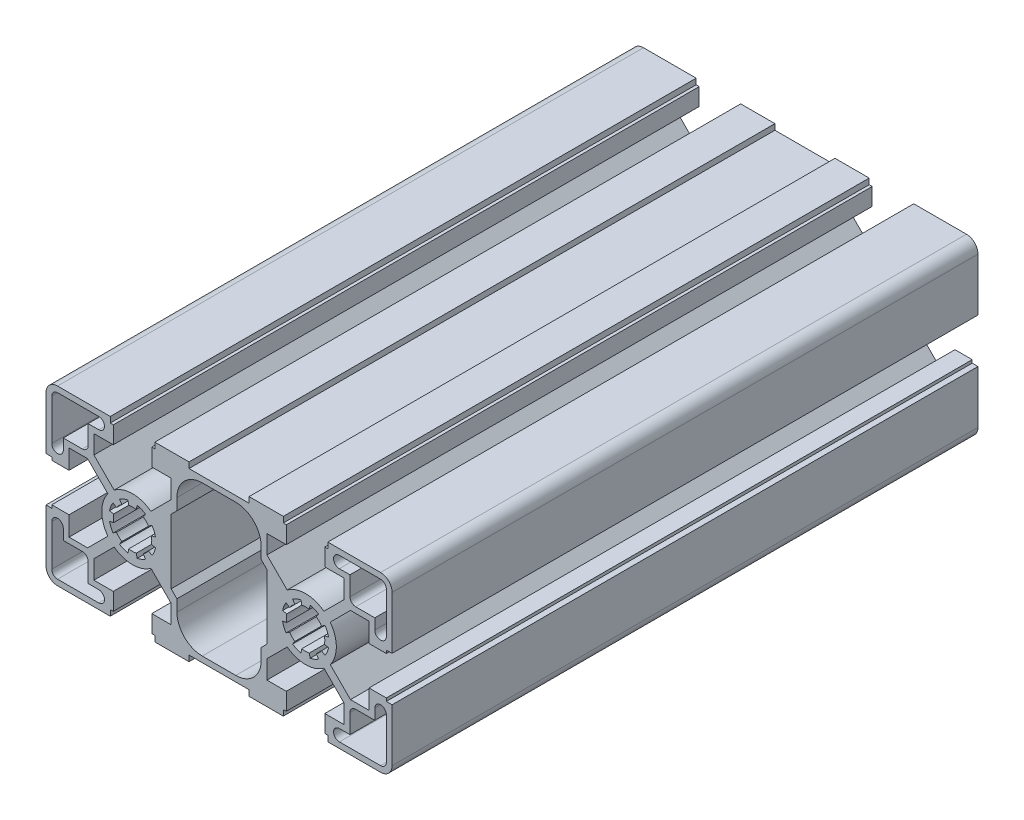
SolidWorks part; units mm, degrees
ref_plane "Front Plane" through (0, 0, 0) normal (0, 0, 1) x (1, 0, 0)
ref_plane "Top Plane" through (0, 0, 0) normal (0, 1, 0) x (1, 0, 0)
ref_plane "Right Plane" through (0, 0, 0) normal (1, 0, 0) x (0, 0, -1)
sketch "Sketch1" plane through (0, 0, 0) normal (0, 0, 1) x (1, 0, 0)
  line L0 (-27.5082, 0) -> (-17.5006, 0) construction
  line L1 (17.5006, 0) -> (27.5082, 0) construction
  line L2 (-42.0116, 22.5044) -> (-28.2956, 22.5044)
  line L3 (-28.2956, 22.5044) -> (-28.2956, 21.0058)
  line L4 (-28.2956, 21.0058) -> (-27.5082, 21.0058)
  line L5 (22.5044, -5.0038) -> (22.5044, 5.0038) construction
  line L6 (-27.5082, 21.0058) -> (-27.5082, 16.51)
  line L7 (-27.5082, 16.51) -> (-32.5501, 16.51)
  line L8 (-32.5501, 16.51) -> (-32.5501, 11.6801)
  line L9 (-32.5501, 11.6801) -> (-27.2854, 6.4154)
  line L11 (-34.1845, 10.0457) -> (-28.9198, 4.781)
  line L12 (-39.0144, 10.0457) -> (-34.1845, 10.0457)
  line L13 (-39.0144, 5.0038) -> (-39.0144, 10.0457)
  line L14 (-43.5102, 5.0038) -> (-39.0144, 5.0038)
  line L15 (-43.5102, 5.7912) -> (-43.5102, 5.0038)
  line L16 (-45.0088, 5.7912) -> (-43.5102, 5.7912)
  line L17 (-45.0088, 19.5072) -> (-45.0088, 5.7912)
  line L18 (-40.513, 11.5443) -> (-35.5473, 11.5443)
  line L19 (-40.513, 11.5443) -> (-40.513, 8.7884)
  line L20 (-34.0487, 18.0086) -> (-34.0487, 13.0429)
  line L21 (-43.5102, 19.5072) -> (-43.5102, 8.7884)
  line L23 (-34.0487, 18.0086) -> (-31.2928, 18.0086)
  line L24 (-42.0116, 21.0058) -> (-31.2928, 21.0058)
  line L25 (-21.3151, 5.9789) -> (-21.5282, 4.9077)
  line L26 (-23.6937, 5.9789) -> (-23.4806, 4.9077)
  line L27 (-17.4358, 3.3868) -> (-18.3439, 2.78)
  line L28 (-19.1176, 5.0686) -> (-19.7244, 4.1605)
  line L29 (-16.5255, -1.1893) -> (-17.5967, -0.9762)
  line L30 (-16.5255, 1.1893) -> (-17.5967, 0.9762)
  line L31 (-19.1176, -5.0686) -> (-19.7244, -4.1605)
  line L32 (-17.4358, -3.3868) -> (-18.3439, -2.78)
  line L33 (-23.6937, -5.9789) -> (-23.4806, -4.9077)
  line L34 (-21.3151, -5.9789) -> (-21.5282, -4.9077)
  line L35 (-27.573, -3.3868) -> (-26.6649, -2.78)
  line L36 (-25.8912, -5.0686) -> (-25.2844, -4.1605)
  line L37 (-28.4833, 1.1893) -> (-27.4121, 0.9762)
  line L38 (-28.4833, -1.1893) -> (-27.4121, -0.9762)
  line L39 (-25.8912, 5.0686) -> (-25.2844, 4.1605)
  line L40 (-27.573, 3.3868) -> (-26.6649, 2.78)
  line L41 (-7.8105, 22.5044) -> (-7.8105, 21.0058)
  line L42 (-7.8105, 21.0058) -> (7.8105, 21.0058)
  line L43 (-7.8105, 22.5044) -> (-16.7132, 22.5044)
  line L44 (-16.7132, 22.5044) -> (-16.7132, 21.0058)
  line L45 (-16.7132, 21.0058) -> (-17.5006, 21.0058)
  line L46 (-17.5006, 21.0058) -> (-17.5006, 16.51)
  line L47 (-17.5006, 16.51) -> (-12.4587, 16.51)
  line L48 (-12.4587, 16.51) -> (-12.4587, 11.6801)
  line L49 (-12.4587, 11.6801) -> (-17.7234, 6.4154)
  line L50 (-10.9601, 9.9099) -> (-12.4587, 8.4113)
  line L51 (7.8105, 21.0058) -> (7.8105, 22.5044)
  line L53 (-7.8105, -22.5044) -> (-16.7132, -22.5044)
  line L54 (7.8105, -22.5044) -> (16.7132, -22.5044)
  line L55 (7.8105, -21.0058) -> (7.8105, -22.5044)
  line L56 (-7.8105, -21.0058) -> (7.8105, -21.0058)
  line L57 (-7.8105, -22.5044) -> (-7.8105, -21.0058)
  line L58 (-40.513, -11.5443) -> (-35.5473, -11.5443)
  line L59 (4.3561, 19.5072) -> (-4.3561, 19.5072)
  line L60 (-10.9601, 12.9032) -> (-10.9601, 9.9099)
  line L61 (-12.4587, -8.4113) -> (-10.9601, -9.9099)
  line L62 (-12.4587, 8.4113) -> (-12.4587, -8.4113)
  line L63 (-10.9601, -12.9032) -> (-10.9601, -9.9099)
  line L64 (4.3561, -19.5072) -> (-4.3561, -19.5072)
  line L65 (10.9601, 12.9032) -> (10.9601, 9.9099)
  line L66 (10.9601, -12.9032) -> (10.9601, -9.9099)
  line L67 (12.4587, 8.4113) -> (12.4587, -8.4113)
  line L68 (10.9601, -9.9099) -> (12.4587, -8.4113)
  line L69 (10.9601, 9.9099) -> (12.4587, 8.4113)
  line L70 (-12.4587, -11.6801) -> (-17.7234, -6.4154)
  line L71 (-12.4587, -16.51) -> (-12.4587, -11.6801)
  line L72 (-17.5006, -16.51) -> (-12.4587, -16.51)
  line L73 (-17.5006, -21.0058) -> (-17.5006, -16.51)
  line L74 (-16.7132, -21.0058) -> (-17.5006, -21.0058)
  line L75 (-16.7132, -22.5044) -> (-16.7132, -21.0058)
  line L76 (-34.0487, -18.0086) -> (-31.2928, -18.0086)
  line L77 (-42.0116, -21.0058) -> (-31.2928, -21.0058)
  line L78 (-42.0116, -22.5044) -> (-28.2956, -22.5044)
  line L79 (-28.2956, -22.5044) -> (-28.2956, -21.0058)
  line L80 (-28.2956, -21.0058) -> (-27.5082, -21.0058)
  line L81 (-27.5082, -21.0058) -> (-27.5082, -16.51)
  line L82 (-27.5082, -16.51) -> (-32.5501, -16.51)
  line L83 (-32.5501, -16.51) -> (-32.5501, -11.6801)
  line L84 (-32.5501, -11.6801) -> (-27.2854, -6.4154)
  line L85 (-34.1845, -10.0457) -> (-28.9198, -4.781)
  line L86 (-43.5102, -19.5072) -> (-43.5102, -8.7884)
  line L87 (-34.0487, -18.0086) -> (-34.0487, -13.0429)
  line L88 (-40.513, -11.5443) -> (-40.513, -8.7884)
  line L89 (-45.0088, -19.5072) -> (-45.0088, -5.7912)
  line L90 (-45.0088, -5.7912) -> (-43.5102, -5.7912)
  line L91 (-43.5102, -5.7912) -> (-43.5102, -5.0038)
  line L92 (-43.5102, -5.0038) -> (-39.0144, -5.0038)
  line L93 (-39.0144, -5.0038) -> (-39.0144, -10.0457)
  line L94 (-39.0144, -10.0457) -> (-34.1845, -10.0457)
  line L96 (42.0116, 21.0058) -> (31.2928, 21.0058)
  line L97 (42.0116, 22.5044) -> (28.2956, 22.5044)
  line L98 (34.0487, 18.0086) -> (31.2928, 18.0086)
  line L99 (27.5082, 21.0058) -> (27.5082, 16.51)
  line L100 (28.2956, 21.0058) -> (27.5082, 21.0058)
  line L101 (28.2956, 22.5044) -> (28.2956, 21.0058)
  line L102 (17.5006, 21.0058) -> (17.5006, 16.51)
  line L103 (16.7132, 21.0058) -> (17.5006, 21.0058)
  line L104 (16.7132, 22.5044) -> (16.7132, 21.0058)
  line L105 (7.8105, 22.5044) -> (16.7132, 22.5044)
  line L106 (39.0144, -10.0457) -> (34.1845, -10.0457)
  line L107 (39.0144, -5.0038) -> (39.0144, -10.0457)
  line L108 (43.5102, -5.0038) -> (39.0144, -5.0038)
  line L109 (43.5102, -5.7912) -> (43.5102, -5.0038)
  line L110 (45.0088, -5.7912) -> (43.5102, -5.7912)
  line L111 (45.0088, -19.5072) -> (45.0088, -5.7912)
  line L112 (40.513, -11.5443) -> (35.5473, -11.5443)
  line L113 (40.513, -11.5443) -> (40.513, -8.7884)
  line L114 (34.0487, -18.0086) -> (34.0487, -13.0429)
  line L115 (43.5102, -19.5072) -> (43.5102, -8.7884)
  line L116 (34.1845, -10.0457) -> (28.9198, -4.781)
  line L117 (32.5501, -11.6801) -> (27.2854, -6.4154)
  line L118 (32.5501, -16.51) -> (32.5501, -11.6801)
  line L119 (27.5082, -16.51) -> (32.5501, -16.51)
  line L120 (27.5082, -21.0058) -> (27.5082, -16.51)
  line L121 (28.2956, -21.0058) -> (27.5082, -21.0058)
  line L122 (28.2956, -22.5044) -> (28.2956, -21.0058)
  line L123 (42.0116, -22.5044) -> (28.2956, -22.5044)
  line L124 (42.0116, -21.0058) -> (31.2928, -21.0058)
  line L125 (34.0487, -18.0086) -> (31.2928, -18.0086)
  line L126 (16.7132, -22.5044) -> (16.7132, -21.0058)
  line L127 (16.7132, -21.0058) -> (17.5006, -21.0058)
  line L128 (17.5006, -21.0058) -> (17.5006, -16.51)
  line L129 (17.5006, -16.51) -> (12.4587, -16.51)
  line L130 (12.4587, -16.51) -> (12.4587, -11.6801)
  line L131 (12.4587, -11.6801) -> (17.7234, -6.4154)
  line L132 (12.4587, 11.6801) -> (17.7234, 6.4154)
  line L133 (12.4587, 16.51) -> (12.4587, 11.6801)
  line L134 (27.573, 3.3868) -> (26.6649, 2.78)
  line L135 (25.8912, 5.0686) -> (25.2844, 4.1605)
  line L136 (28.4833, -1.1893) -> (27.4121, -0.9762)
  line L137 (28.4833, 1.1893) -> (27.4121, 0.9762)
  line L138 (25.8912, -5.0686) -> (25.2844, -4.1605)
  line L139 (27.573, -3.3868) -> (26.6649, -2.78)
  line L140 (21.3151, -5.9789) -> (21.5282, -4.9077)
  line L141 (23.6937, -5.9789) -> (23.4806, -4.9077)
  line L142 (17.4358, -3.3868) -> (18.3439, -2.78)
  line L143 (19.1176, -5.0686) -> (19.7244, -4.1605)
  line L144 (16.5255, 1.1893) -> (17.5967, 0.9762)
  line L145 (16.5255, -1.1893) -> (17.5967, -0.9762)
  line L146 (19.1176, 5.0686) -> (19.7244, 4.1605)
  line L147 (17.4358, 3.3868) -> (18.3439, 2.78)
  line L148 (23.6937, 5.9789) -> (23.4806, 4.9077)
  line L149 (21.3151, 5.9789) -> (21.5282, 4.9077)
  line L150 (43.5102, 19.5072) -> (43.5102, 8.7884)
  line L151 (34.0487, 18.0086) -> (34.0487, 13.0429)
  line L152 (40.513, 11.5443) -> (40.513, 8.7884)
  line L153 (40.513, 11.5443) -> (35.5473, 11.5443)
  line L154 (45.0088, 19.5072) -> (45.0088, 5.7912)
  line L155 (45.0088, 5.7912) -> (43.5102, 5.7912)
  line L156 (43.5102, 5.7912) -> (43.5102, 5.0038)
  line L157 (43.5102, 5.0038) -> (39.0144, 5.0038)
  line L158 (39.0144, 5.0038) -> (39.0144, 10.0457)
  line L159 (39.0144, 10.0457) -> (34.1845, 10.0457)
  line L160 (34.1845, 10.0457) -> (28.9198, 4.781)
  line L161 (32.5501, 11.6801) -> (27.2854, 6.4154)
  line L162 (32.5501, 16.51) -> (32.5501, 11.6801)
  line L163 (12.4587, 16.51) -> (17.5006, 16.51)
  line L164 (27.5082, 16.51) -> (32.5501, 16.51)
  arc A0 (-45.0088, 19.5072) -> (-42.0116, 22.5044) centre (-42.0116, 19.5072) cw
  arc A1 (-43.5102, 8.7884) -> (-40.513, 8.7884) centre (-42.0116, 8.7884) ccw
  arc A2 (-43.5102, 19.5072) -> (-42.0116, 21.0058) centre (-42.0116, 19.5072) cw
  arc A3 (-31.2928, 21.0058) -> (-31.2928, 18.0086) centre (-31.2928, 19.5072) cw
  arc A4 (-34.0487, 13.0429) -> (-35.5473, 11.5443) centre (-35.5473, 13.0429) cw
  arc A6 (-21.5282, 4.9077) -> (-23.4806, 4.9077) centre (-22.5044, 0) ccw
  arc A7 (-27.573, 3.3868) -> (-28.4833, 1.1893) centre (-22.5044, 0) ccw
  arc A8 (-18.3439, 2.78) -> (-19.7244, 4.1605) centre (-22.5044, 0) ccw
  arc A9 (-17.5967, -0.9762) -> (-17.5967, 0.9762) centre (-22.5044, 0) ccw
  arc A10 (-19.7244, -4.1605) -> (-18.3439, -2.78) centre (-22.5044, 0) ccw
  arc A11 (-23.4806, -4.9077) -> (-21.5282, -4.9077) centre (-22.5044, 0) ccw
  arc A12 (-26.6649, -2.78) -> (-25.2844, -4.1605) centre (-22.5044, 0) ccw
  arc A13 (-27.4121, 0.9762) -> (-27.4121, -0.9762) centre (-22.5044, 0) ccw
  arc A14 (-25.2844, 4.1605) -> (-26.6649, 2.78) centre (-22.5044, 0) ccw
  arc A15 (-28.4833, -1.1893) -> (-27.573, -3.3868) centre (-22.5044, 0) ccw
  arc A16 (-25.8912, -5.0686) -> (-23.6937, -5.9789) centre (-22.5044, 0) ccw
  arc A17 (-21.3151, -5.9789) -> (-19.1176, -5.0686) centre (-22.5044, 0) ccw
  arc A18 (-17.4358, -3.3868) -> (-16.5255, -1.1893) centre (-22.5044, 0) ccw
  arc A19 (-16.5255, 1.1893) -> (-17.4358, 3.3868) centre (-22.5044, 0) ccw
  arc A20 (-19.1176, 5.0686) -> (-21.3151, 5.9789) centre (-22.5044, 0) ccw
  arc A21 (-23.6937, 5.9789) -> (-25.8912, 5.0686) centre (-22.5044, 0) ccw
  arc A22 (-34.0487, -13.0429) -> (-35.5473, -11.5443) centre (-35.5473, -13.0429) ccw
  arc A23 (-4.3561, 19.5072) -> (-10.9601, 12.9032) centre (-4.3561, 12.9032) ccw
  arc A24 (-4.3561, -19.5072) -> (-10.9601, -12.9032) centre (-4.3561, -12.9032) cw
  arc A25 (4.3561, 19.5072) -> (10.9601, 12.9032) centre (4.3561, 12.9032) cw
  arc A26 (4.3561, -19.5072) -> (10.9601, -12.9032) centre (4.3561, -12.9032) ccw
  arc A27 (-31.2928, -21.0058) -> (-31.2928, -18.0086) centre (-31.2928, -19.5072) ccw
  arc A28 (-43.5102, -19.5072) -> (-42.0116, -21.0058) centre (-42.0116, -19.5072) ccw
  arc A29 (-45.0088, -19.5072) -> (-42.0116, -22.5044) centre (-42.0116, -19.5072) ccw
  arc A30 (-43.5102, -8.7884) -> (-40.513, -8.7884) centre (-42.0116, -8.7884) cw
  arc A31 (-17.7234, 6.4154) -> (-27.2854, 6.4154) centre (-22.5044, 0) ccw
  arc A32 (-27.2854, -6.4154) -> (-17.7234, -6.4154) centre (-22.5044, 0) ccw
  arc A33 (-28.9198, 4.781) -> (-28.9198, -4.781) centre (-22.5044, 0) ccw
  arc A34 (45.0088, 19.5072) -> (42.0116, 22.5044) centre (42.0116, 19.5072) ccw
  arc A35 (43.5102, 19.5072) -> (42.0116, 21.0058) centre (42.0116, 19.5072) ccw
  arc A36 (31.2928, 21.0058) -> (31.2928, 18.0086) centre (31.2928, 19.5072) ccw
  arc A37 (28.9198, 4.781) -> (28.9198, -4.781) centre (22.5044, 0) cw
  arc A38 (27.2854, -6.4154) -> (17.7234, -6.4154) centre (22.5044, 0) cw
  arc A39 (17.7234, 6.4154) -> (27.2854, 6.4154) centre (22.5044, 0) cw
  arc A40 (43.5102, -8.7884) -> (40.513, -8.7884) centre (42.0116, -8.7884) ccw
  arc A41 (34.0487, -13.0429) -> (35.5473, -11.5443) centre (35.5473, -13.0429) cw
  arc A42 (45.0088, -19.5072) -> (42.0116, -22.5044) centre (42.0116, -19.5072) cw
  arc A43 (43.5102, -19.5072) -> (42.0116, -21.0058) centre (42.0116, -19.5072) cw
  arc A44 (31.2928, -21.0058) -> (31.2928, -18.0086) centre (31.2928, -19.5072) cw
  arc A45 (23.6937, 5.9789) -> (25.8912, 5.0686) centre (22.5044, 0) cw
  arc A46 (19.1176, 5.0686) -> (21.3151, 5.9789) centre (22.5044, 0) cw
  arc A47 (16.5255, 1.1893) -> (17.4358, 3.3868) centre (22.5044, 0) cw
  arc A48 (17.4358, -3.3868) -> (16.5255, -1.1893) centre (22.5044, 0) cw
  arc A49 (21.3151, -5.9789) -> (19.1176, -5.0686) centre (22.5044, 0) cw
  arc A50 (25.8912, -5.0686) -> (23.6937, -5.9789) centre (22.5044, 0) cw
  arc A51 (28.4833, -1.1893) -> (27.573, -3.3868) centre (22.5044, 0) cw
  arc A52 (25.2844, 4.1605) -> (26.6649, 2.78) centre (22.5044, 0) cw
  arc A53 (27.4121, 0.9762) -> (27.4121, -0.9762) centre (22.5044, 0) cw
  arc A54 (26.6649, -2.78) -> (25.2844, -4.1605) centre (22.5044, 0) cw
  arc A55 (23.4806, -4.9077) -> (21.5282, -4.9077) centre (22.5044, 0) cw
  arc A56 (19.7244, -4.1605) -> (18.3439, -2.78) centre (22.5044, 0) cw
  arc A57 (17.5967, -0.9762) -> (17.5967, 0.9762) centre (22.5044, 0) cw
  arc A58 (18.3439, 2.78) -> (19.7244, 4.1605) centre (22.5044, 0) cw
  arc A59 (27.573, 3.3868) -> (28.4833, 1.1893) centre (22.5044, 0) cw
  arc A60 (21.5282, 4.9077) -> (23.4806, 4.9077) centre (22.5044, 0) cw
  arc A62 (34.0487, 13.0429) -> (35.5473, 11.5443) centre (35.5473, 13.0429) ccw
  arc A63 (43.5102, 8.7884) -> (40.513, 8.7884) centre (42.0116, 8.7884) cw
extrude "Boss-Extrude1" add sketch "Sketch1" along normal mid plane 152.4
